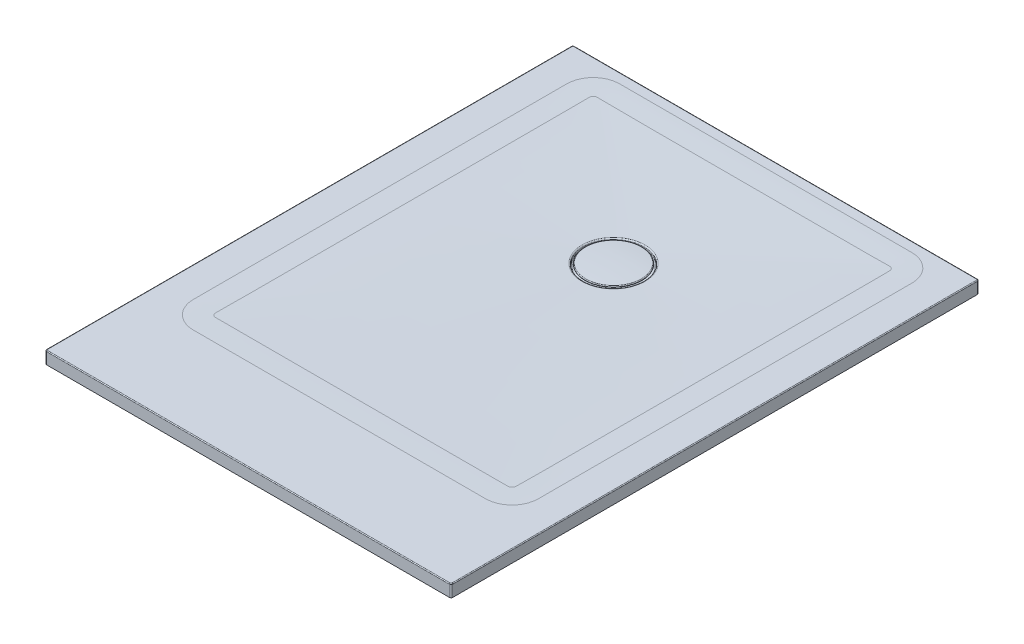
SolidWorks part; units mm, degrees
ref_plane "Płaszczyzna przednia" through (0, 0, 0) normal (0, 0, 1) x (1, 0, 0)
ref_plane "Płaszczyzna górna" through (0, 0, 0) normal (0, 1, 0) x (1, 0, 0)
ref_plane "Płaszczyzna prawa" through (0, 0, 0) normal (1, 0, 0) x (0, 0, -1)
sketch "Szkic2" plane through (0, 0, 0) normal (0, 1, 0) x (1, 0, 0)
  line L0 (0, 650) -> (0, 250) construction
  line L1 (-500, -650) -> (500, -650)
  line L2 (-500, -650) -> (-500, 650)
  line L3 (-500, 650) -> (500, 650)
  line L4 (500, -650) -> (500, 650)
  line L5 (-500, -650) -> (500, 650) construction
  line L6 (-500, 650) -> (500, -650) construction
  line L7 (-410, 610) -> (410, 610)
  line L8 (-410, 610) -> (-410, -410)
  line L9 (-410, -410) -> (410, -410)
  line L10 (410, 610) -> (410, -410)
  line L11 (-450, 650) -> (-450, -450) construction
  line L12 (-450, -450) -> (450, -450) construction
  line L13 (450, -450) -> (450, 650) construction
  circle A0 centre (0, 250) radius 75
  point P0 (0, 0)
  point P11 (0, 610)
  point P16 (0, -450)
  dimension "D9" = 150
  dimension "D1" = 1000
  dimension "D2" = 1300
  dimension "D3" = 40
  dimension "D4" = 90
  dimension "D5" = 40
  dimension "D6" = 50
  dimension "D7" = 1100
  dimension "D8" = 400
  dimension "D10" = 900
sketch "Szkic3" plane through (0, 0, 0) normal (0, 1, 0) x (1, 0, 0)
  line L0 (-500, -650) -> (-500, 650) construction
  line L1 (-500, -650) -> (500, -650) construction
  line L2 (500, -650) -> (500, 650) construction
  line L3 (-500, 650) -> (500, 650) construction
  line L4 (-410, 610) -> (-410, -410) construction
  line L5 (-410, 610) -> (410, 610) construction
  line L6 (410, 610) -> (410, -410) construction
  line L7 (-410, -410) -> (410, -410) construction
  line L8 (-500, -650) -> (-500, 650)
  line L9 (-500, -650) -> (500, -650)
  line L10 (500, -650) -> (500, 650)
  line L11 (-500, 650) -> (500, 650)
  line L12 (-410, 560) -> (-410, -360)
  line L13 (-360, 610) -> (360, 610)
  line L14 (410, 560) -> (410, -360)
  line L15 (-360, -410) -> (360, -410)
  arc A0 (410, 560) -> (360, 610) centre (360, 560) ccw
  arc A1 (-360, 610) -> (-410, 560) centre (-360, 560) ccw
  arc A2 (360, -410) -> (410, -360) centre (360, -360) ccw
  arc A3 (-360, -410) -> (-410, -360) centre (-360, -360) cw
  dimension "D1" = 50
surface "Powierzchnia-Płaszczyzna1" sketch "Szkic3"
sketch "Szkic4" plane through (0, 0, 0) normal (0, 1, 0) x (1, 0, 0)
  line L0 (-410, 610) -> (-410, -410) construction
  line L1 (-410, -410) -> (410, -410) construction
  line L2 (410, 610) -> (410, -410) construction
  line L3 (-410, 610) -> (410, 610) construction
  line L4 (-410, 610) -> (-410, -410)
  line L5 (-410, -410) -> (410, -410)
  line L6 (410, 610) -> (410, -410)
  line L7 (-410, 610) -> (410, 610)
ref_plane "korek" through (0, -15, 0) normal (0, 1, 0) x (-1, 0, 0)
sketch "Szkic5" plane through (0, -15, 0) normal (0, 1, 0) x (-1, 0, 0)
  circle A0 centre (0, -250) radius 75 construction
  circle A1 centre (0, -250) radius 75
surface "Powierzchnia-Wyciągnięcie po profilach2"
surface "Powierzchnia-Połącz1"
sketch "Szkic7" plane through (0, 0, 0) normal (0, 1, 0) x (1, 0, 0)
  line L27 (360, 570) -> (-360, 570)
  line L28 (-370, 560) -> (-370, -360)
  line L29 (-360, -370) -> (360, -370)
  line L30 (370, -360) -> (370, 560)
  line L31 (360, 570) -> (-360, 570)
  line L32 (-370, 560) -> (-370, -360)
  line L33 (-360, -370) -> (360, -370)
  line L34 (370, -360) -> (370, 560)
  line L35 (360, 625) -> (-360, 625)
  line L36 (-425, 560) -> (-425, -360)
  line L37 (-360, -425) -> (360, -425)
  line L38 (425, -360) -> (425, 560)
  line L39 (360, 625) -> (-360, 625)
  line L40 (-425, 560) -> (-425, -360)
  line L41 (-360, -425) -> (360, -425)
  line L42 (425, -360) -> (425, 560)
  arc A0 (370, -360) -> (360, -370) centre (360, -360) cw
  arc A1 (-370, -360) -> (-360, -370) centre (-360, -360) ccw
  arc A2 (370, 560) -> (360, 570) centre (360, 560) ccw
  arc A3 (-370, 560) -> (-360, 570) centre (-360, 560) cw
  spline S23 degree 3 poles (-591.6118, 285.5954) (182.5036, 455.0072) (377.0274, 525.6648) (369.7448, 562.2676) (369.6661, 562.5843) (369.4757, 563.2121) (369.3642, 563.5243) (368.988, 564.4321) (368.6812, 565.0063) (368.1376, 565.8212) (367.9416, 566.0859) (367.5238, 566.5956) (367.3039, 566.838) (366.6126, 567.5299) (366.1097, 567.9438) (365.2907, 568.4922) (365.0068, 568.6625) (364.43, 568.9712) (364.1354, 569.1107) (363.5343, 569.3603) (363.2277, 569.4705) (362.6024, 569.6612) (362.282, 569.7413) (361.6362, 569.8713) (361.3114, 569.9186) (360.8216, 569.967) (360.658, 569.9803) (347.6095, 570.6434) (331.0947, 538.6328) (432.467, 1567.3466) knots -6.976657 -6.976657 -6.976657 -6.976657 0.125 0.125 0.1875 0.1875 0.25 0.25 0.375 0.375 0.4375 0.4375 0.5 0.5 0.625 0.625 0.6875 0.6875 0.75 0.75 0.8125 0.8125 0.875 0.875 0.9375 0.9375 0.96875 0.96875 3.42199 3.42199 3.42199 3.42199 only from (370, 560) to (360, 570)
  spline S24 degree 3 poles (-490.2746, 1561.4753) (-329.0821, 538.5443) (-347.5771, 570.6441) (-360.657, 569.9803) (-360.8198, 569.9671) (-361.3069, 569.9191) (-361.629, 569.8724) (-362.2676, 569.7446) (-362.5844, 569.666) (-363.2123, 569.4758) (-363.5244, 569.3641) (-364.4323, 568.9881) (-365.0064, 568.6812) (-365.8214, 568.1375) (-366.0862, 567.9415) (-366.5957, 567.5237) (-366.8382, 567.3038) (-367.5299, 566.6125) (-367.9439, 566.1095) (-368.4922, 565.2905) (-368.6624, 565.0067) (-368.9713, 564.4299) (-369.1107, 564.1354) (-369.3603, 563.5342) (-369.4704, 563.2276) (-369.6613, 562.6023) (-369.7416, 562.282) (-379.3458, 514.2897) (-36.4064, 427.4202) (597.7666, 308.1619) knots -2.434984 -2.434984 -2.434984 -2.434984 0.03125 0.03125 0.0625 0.0625 0.125 0.125 0.1875 0.1875 0.25 0.25 0.375 0.375 0.4375 0.4375 0.5 0.5 0.625 0.625 0.6875 0.6875 0.75 0.75 0.8125 0.8125 0.875 0.875 10.101399 10.101399 10.101399 10.101399 only from (-360, 570) to (-370, 560)
  spline S25 degree 3 poles (591.6121, -85.5953) (-182.5036, -255.0072) (-377.0274, -325.6648) (-369.7448, -362.2676) (-369.6661, -362.5843) (-369.4757, -363.2121) (-369.3642, -363.5243) (-368.988, -364.4321) (-368.6812, -365.0063) (-368.1376, -365.8212) (-367.9416, -366.0859) (-367.5238, -366.5956) (-367.3039, -366.838) (-366.6126, -367.5299) (-366.1097, -367.9438) (-365.2907, -368.4922) (-365.0068, -368.6625) (-364.43, -368.9712) (-364.1354, -369.1107) (-363.5343, -369.3603) (-363.2277, -369.4705) (-362.6024, -369.6612) (-362.282, -369.7413) (-361.6362, -369.8713) (-361.3114, -369.9186) (-360.8216, -369.967) (-360.658, -369.9803) (-347.6095, -370.6434) (-331.0947, -338.6328) (-432.467, -1367.3466) knots -6.976657 -6.976657 -6.976657 -6.976657 0.125 0.125 0.1875 0.1875 0.25 0.25 0.375 0.375 0.4375 0.4375 0.5 0.5 0.625 0.625 0.6875 0.6875 0.75 0.75 0.8125 0.8125 0.875 0.875 0.9375 0.9375 0.96875 0.96875 3.42199 3.42199 3.42199 3.42199 only from (-370, -360) to (-360, -370)
  spline S26 degree 3 poles (490.2746, -1361.4751) (329.0821, -338.5443) (347.5771, -370.6441) (360.657, -369.9803) (360.8198, -369.9671) (361.3069, -369.9191) (361.629, -369.8724) (362.2676, -369.7446) (362.5844, -369.666) (363.2123, -369.4758) (363.5244, -369.3641) (364.4323, -368.9881) (365.0064, -368.6812) (365.8214, -368.1375) (366.0862, -367.9415) (366.5957, -367.5237) (366.8382, -367.3038) (367.5299, -366.6125) (367.9439, -366.1095) (368.4922, -365.2905) (368.6624, -365.0067) (368.9713, -364.4299) (369.1107, -364.1354) (369.3603, -363.5342) (369.4704, -363.2276) (369.6613, -362.6023) (369.7416, -362.282) (379.3458, -314.2897) (36.4064, -227.4202) (-597.7666, -108.1619) knots -2.434984 -2.434984 -2.434984 -2.434984 0.03125 0.03125 0.0625 0.0625 0.125 0.125 0.1875 0.1875 0.25 0.25 0.375 0.375 0.4375 0.4375 0.5 0.5 0.625 0.625 0.6875 0.6875 0.75 0.75 0.8125 0.8125 0.875 0.875 10.101399 10.101399 10.101399 10.101399 only from (360, -370) to (370, -360)
  spline S31 degree 3 poles (-2396.7641, -416.5637) (-141.6727, 137.224) (456.3366, 408.6659) (423.3422, 574.7388) (422.8286, 576.7972) (421.9015, 579.8581) (421.5658, 580.8756) (420.844, 582.8942) (420.4597, 583.8906) (418.4227, 588.8082) (416.4284, 592.5401) (413.4836, 596.9544) (412.8719, 597.8247) (411.602, 599.5395) (410.9422, 600.3861) (408.9052, 602.8704) (407.4762, 604.4466) (402.9826, 608.9435) (399.7135, 611.6341) (395.2773, 614.6045) (394.3699, 615.1802) (392.5353, 616.2814) (391.6079, 616.8073) (388.7957, 618.3124) (386.8812, 619.2189) (382.9738, 620.8415) (380.9809, 621.5575) (377.9322, 622.4867) (376.9059, 622.7721) (374.8332, 623.2937) (373.7848, 623.5304) (370.636, 624.1602) (368.5249, 624.4734) (365.3411, 624.7884) (364.2771, 624.8686) (221.1012, 631.9728) (25.0091, 152.9101) (265.0303, 3601.0082) knots -4.813168 -4.813168 -4.813168 -4.813168 0.125 0.125 0.1875 0.1875 0.21875 0.21875 0.25 0.25 0.375 0.375 0.40625 0.40625 0.4375 0.4375 0.5 0.5 0.625 0.625 0.65625 0.65625 0.6875 0.6875 0.75 0.75 0.8125 0.8125 0.84375 0.84375 0.875 0.875 0.9375 0.9375 0.96875 0.96875 5.130618 5.130618 5.130618 5.130618 only from (425, 560) to (360, 625)
  spline S32 degree 3 poles (-415.8595, 3598.7851) (29.0708, 99.1406) (-213.1262, 632.3577) (-364.2695, 624.869) (-365.3289, 624.7893) (-368.4945, 624.477) (-370.5877, 624.1674) (-374.7388, 623.3419) (-376.7973, 622.8285) (-379.8582, 621.9015) (-380.8757, 621.5657) (-382.8943, 620.844) (-383.8907, 620.4597) (-388.8083, 618.4228) (-392.5402, 616.4283) (-396.9546, 613.4835) (-397.8248, 612.8718) (-399.5396, 611.6019) (-400.3863, 610.9421) (-402.8705, 608.9051) (-404.4468, 607.4761) (-408.9435, 602.9825) (-411.6342, 599.7134) (-414.6045, 595.2773) (-415.1803, 594.3698) (-416.2814, 592.5352) (-416.8073, 591.6078) (-418.3124, 588.7957) (-419.2189, 586.8811) (-420.8415, 582.9737) (-421.5574, 580.9808) (-422.4867, 577.9321) (-422.7721, 576.9059) (-423.2937, 574.8332) (-423.5304, 573.7848) (-462.8094, 377.2436) (405.121, 81.0334) (2419.4038, -342.4744) knots -4.376745 -4.376745 -4.376745 -4.376745 0.03125 0.03125 0.0625 0.0625 0.125 0.125 0.1875 0.1875 0.21875 0.21875 0.25 0.25 0.375 0.375 0.40625 0.40625 0.4375 0.4375 0.5 0.5 0.625 0.625 0.65625 0.65625 0.6875 0.6875 0.75 0.75 0.8125 0.8125 0.84375 0.84375 0.875 0.875 6.695249 6.695249 6.695249 6.695249 only from (-360, 625) to (-425, 560)
  spline S33 degree 3 poles (2396.7641, 616.5637) (141.6727, 62.776) (-456.3366, -208.6659) (-423.3422, -374.7388) (-422.8286, -376.7972) (-421.9015, -379.8581) (-421.5658, -380.8756) (-420.844, -382.8942) (-420.4597, -383.8906) (-418.4227, -388.8082) (-416.4284, -392.5401) (-413.4836, -396.9544) (-412.8719, -397.8247) (-411.602, -399.5395) (-410.9422, -400.3861) (-408.9052, -402.8704) (-407.4762, -404.4466) (-402.9826, -408.9435) (-399.7135, -411.6341) (-395.2773, -414.6045) (-394.3699, -415.1802) (-392.5353, -416.2814) (-391.6079, -416.8073) (-388.7957, -418.3124) (-386.8812, -419.2189) (-382.9738, -420.8415) (-380.9809, -421.5575) (-377.9322, -422.4867) (-376.9059, -422.7721) (-374.8332, -423.2937) (-373.7848, -423.5304) (-370.636, -424.1602) (-368.5249, -424.4734) (-365.3411, -424.7884) (-364.2771, -424.8686) (-221.1012, -431.9728) (-25.0091, 47.0899) (-265.0303, -3401.0082) knots -4.813168 -4.813168 -4.813168 -4.813168 0.125 0.125 0.1875 0.1875 0.21875 0.21875 0.25 0.25 0.375 0.375 0.40625 0.40625 0.4375 0.4375 0.5 0.5 0.625 0.625 0.65625 0.65625 0.6875 0.6875 0.75 0.75 0.8125 0.8125 0.84375 0.84375 0.875 0.875 0.9375 0.9375 0.96875 0.96875 5.130618 5.130618 5.130618 5.130618 only from (-425, -360) to (-360, -425)
  spline S34 degree 3 poles (415.8595, -3398.7854) (-29.0708, 100.8594) (213.1262, -432.3577) (364.2695, -424.869) (365.3289, -424.7893) (368.4945, -424.477) (370.5877, -424.1674) (374.7388, -423.3419) (376.7973, -422.8285) (379.8582, -421.9015) (380.8757, -421.5657) (382.8943, -420.844) (383.8907, -420.4597) (388.8083, -418.4228) (392.5402, -416.4283) (396.9546, -413.4835) (397.8248, -412.8718) (399.5396, -411.6019) (400.3863, -410.9421) (402.8705, -408.9051) (404.4468, -407.4761) (408.9435, -402.9825) (411.6342, -399.7134) (414.6045, -395.2773) (415.1803, -394.3698) (416.2814, -392.5352) (416.8073, -391.6078) (418.3124, -388.7957) (419.2189, -386.8811) (420.8415, -382.9737) (421.5574, -380.9808) (422.4867, -377.9321) (422.7721, -376.9059) (423.2937, -374.8332) (423.5304, -373.7848) (462.8094, -177.2436) (-405.121, 118.9666) (-2419.4038, 542.4744) knots -4.376745 -4.376745 -4.376745 -4.376745 0.03125 0.03125 0.0625 0.0625 0.125 0.125 0.1875 0.1875 0.21875 0.21875 0.25 0.25 0.375 0.375 0.40625 0.40625 0.4375 0.4375 0.5 0.5 0.625 0.625 0.65625 0.65625 0.6875 0.6875 0.75 0.75 0.8125 0.8125 0.84375 0.84375 0.875 0.875 6.695249 6.695249 6.695249 6.695249 only from (360, -425) to (425, -360)
  spline S35 degree 3 poles (425, 560) (425, 564.2918) (424.5793, 568.5119) (423.3422, 574.7388) (422.8286, 576.7972) (421.9015, 579.8581) (421.5658, 580.8756) (420.844, 582.8942) (420.4597, 583.8906) (418.4227, 588.8082) (416.4284, 592.5401) (413.4836, 596.9544) (412.8719, 597.8247) (411.602, 599.5395) (410.9422, 600.3861) (408.9052, 602.8704) (407.4762, 604.4466) (402.9826, 608.9435) (399.7135, 611.6341) (395.2773, 614.6045) (394.3699, 615.1802) (392.5353, 616.2814) (391.6079, 616.8073) (388.7957, 618.3124) (386.8812, 619.2189) (382.9738, 620.8415) (380.9809, 621.5575) (377.9322, 622.4867) (376.9059, 622.7721) (374.8332, 623.2937) (373.7848, 623.5304) (370.636, 624.1602) (368.5249, 624.4734) (365.3411, 624.7884) (364.2771, 624.8686) (362.143, 624.9745) (361.0729, 625) (360, 625) knots 0 0 0 0 0.125 0.125 0.1875 0.1875 0.21875 0.21875 0.25 0.25 0.375 0.375 0.40625 0.40625 0.4375 0.4375 0.5 0.5 0.625 0.625 0.65625 0.65625 0.6875 0.6875 0.75 0.75 0.8125 0.8125 0.84375 0.84375 0.875 0.875 0.9375 0.9375 0.96875 0.96875 1 1 1 1
  spline S36 degree 3 poles (-360, 625) (-361.073, 625) (-362.1416, 624.9745) (-364.2695, 624.869) (-365.3289, 624.7893) (-368.4945, 624.477) (-370.5877, 624.1674) (-374.7388, 623.3419) (-376.7973, 622.8285) (-379.8582, 621.9015) (-380.8757, 621.5657) (-382.8943, 620.844) (-383.8907, 620.4597) (-388.8083, 618.4228) (-392.5402, 616.4283) (-396.9546, 613.4835) (-397.8248, 612.8718) (-399.5396, 611.6019) (-400.3863, 610.9421) (-402.8705, 608.9051) (-404.4468, 607.4761) (-408.9435, 602.9825) (-411.6342, 599.7134) (-414.6045, 595.2773) (-415.1803, 594.3698) (-416.2814, 592.5352) (-416.8073, 591.6078) (-418.3124, 588.7957) (-419.2189, 586.8811) (-420.8415, 582.9737) (-421.5574, 580.9808) (-422.4867, 577.9321) (-422.7721, 576.9059) (-423.2937, 574.8332) (-423.5304, 573.7848) (-424.5793, 568.5367) (-425, 564.2917) (-425, 560) knots 0 0 0 0 0.03125 0.03125 0.0625 0.0625 0.125 0.125 0.1875 0.1875 0.21875 0.21875 0.25 0.25 0.375 0.375 0.40625 0.40625 0.4375 0.4375 0.5 0.5 0.625 0.625 0.65625 0.65625 0.6875 0.6875 0.75 0.75 0.8125 0.8125 0.84375 0.84375 0.875 0.875 1 1 1 1
  spline S37 degree 3 poles (-425, -360) (-425, -364.2918) (-424.5793, -368.5119) (-423.3422, -374.7388) (-422.8286, -376.7972) (-421.9015, -379.8581) (-421.5658, -380.8756) (-420.844, -382.8942) (-420.4597, -383.8906) (-418.4227, -388.8082) (-416.4284, -392.5401) (-413.4836, -396.9544) (-412.8719, -397.8247) (-411.602, -399.5395) (-410.9422, -400.3861) (-408.9052, -402.8704) (-407.4762, -404.4466) (-402.9826, -408.9435) (-399.7135, -411.6341) (-395.2773, -414.6045) (-394.3699, -415.1802) (-392.5353, -416.2814) (-391.6079, -416.8073) (-388.7957, -418.3124) (-386.8812, -419.2189) (-382.9738, -420.8415) (-380.9809, -421.5575) (-377.9322, -422.4867) (-376.9059, -422.7721) (-374.8332, -423.2937) (-373.7848, -423.5304) (-370.636, -424.1602) (-368.5249, -424.4734) (-365.3411, -424.7884) (-364.2771, -424.8686) (-362.143, -424.9745) (-361.0729, -425) (-360, -425) knots 0 0 0 0 0.125 0.125 0.1875 0.1875 0.21875 0.21875 0.25 0.25 0.375 0.375 0.40625 0.40625 0.4375 0.4375 0.5 0.5 0.625 0.625 0.65625 0.65625 0.6875 0.6875 0.75 0.75 0.8125 0.8125 0.84375 0.84375 0.875 0.875 0.9375 0.9375 0.96875 0.96875 1 1 1 1
  spline S38 degree 3 poles (360, -425) (361.073, -425) (362.1416, -424.9745) (364.2695, -424.869) (365.3289, -424.7893) (368.4945, -424.477) (370.5877, -424.1674) (374.7388, -423.3419) (376.7973, -422.8285) (379.8582, -421.9015) (380.8757, -421.5657) (382.8943, -420.844) (383.8907, -420.4597) (388.8083, -418.4228) (392.5402, -416.4283) (396.9546, -413.4835) (397.8248, -412.8718) (399.5396, -411.6019) (400.3863, -410.9421) (402.8705, -408.9051) (404.4468, -407.4761) (408.9435, -402.9825) (411.6342, -399.7134) (414.6045, -395.2773) (415.1803, -394.3698) (416.2814, -392.5352) (416.8073, -391.6078) (418.3124, -388.7957) (419.2189, -386.8811) (420.8415, -382.9737) (421.5574, -380.9808) (422.4867, -377.9321) (422.7721, -376.9059) (423.2937, -374.8332) (423.5304, -373.7848) (424.5793, -368.5367) (425, -364.2917) (425, -360) knots 0 0 0 0 0.03125 0.03125 0.0625 0.0625 0.125 0.125 0.1875 0.1875 0.21875 0.21875 0.25 0.25 0.375 0.375 0.40625 0.40625 0.4375 0.4375 0.5 0.5 0.625 0.625 0.65625 0.65625 0.6875 0.6875 0.75 0.75 0.8125 0.8125 0.84375 0.84375 0.875 0.875 1 1 1 1
  dimension "D3" = 10
  dimension "D1" = 40
  dimension "D2" = 15
other "Usuń ścianę1"
other "Granica-Powierzchnia1"
surface "Powierzchnia-Połącz2"
sketch "Szkic9" plane through (0, 0, 0) normal (0, 1, 0) x (1, 0, 0)
  line L0 (-500, -650) -> (500, -650) construction
  line L1 (-500, -650) -> (-500, 650) construction
  line L2 (500, -650) -> (500, 650) construction
  line L3 (-500, 650) -> (500, 650) construction
  line L4 (-500, -650) -> (500, -650)
  line L5 (-500, -650) -> (-500, 650)
  line L6 (500, -650) -> (500, 650)
  line L7 (-500, 650) -> (500, 650)
surface "Powierzchnia-Wyciągnięcie1" sketch "Szkic9" parameters "D1"=30
sketch "Szkic8" plane through (0, 0, 0) normal (1, 0, 0) x (0, 0, -1)
  line L0 (250, 0) -> (250, -30) construction
  line L1 (174.9999, -15) -> (175.2968, -23.5)
  line L4 (175.2968, -23.5) -> (198, -24.0945)
  line L5 (175.2968, -23.5) -> (250, -23.5) construction
  line L6 (198, -24.0945) -> (198, -30) construction
  line L7 (250, -30) -> (175.2968, -30) construction
  line L8 (175.2968, -30) -> (175.2968, -23.5) construction
  line L9 (205, -28) -> (205, -30)
  line L10 (198, -24.0945) -> (205, -28)
  dimension "D1" = 30
  dimension "D2" = 8.5
  dimension "D3" = 2
  dimension "D4" = 1.5
  dimension "D5" = 52
  dimension "D6" = 45
  dimension "D7" = 2
surface "Powierzchnia-Obrót1" sketch "Szkic8" parameters "D1"=360
surface "Powierzchnia-Płaszczyzna2"
surface "Powierzchnia-Połącz3"
fillet "Zaokrąglenie4" radius 4 4 edges at (-500, -15, -650) (500, -15, -650) (-500, -15, 650) (500, -15, 650)
fillet "Zaokrąglenie5" radius 3 3 edges at (0, -24.0945, -302) (0, -23.5, -324.7032)
fillet "Zaokrąglenie6" radius 2 9 edges at (498.8284, 0, 648.8284) (0, 0, 650) (-498.8284, 0, 648.8284) (-500, 0, 0) (-498.8284, 0, -648.8284) (0, 0, -650) (498.8284, 0, -648.8284) (500, 0, 0) (0, -28, -295)
sketch "Szkic11" plane through (0, 0, 0) normal (1, 0, 0) x (0, 0, -1)
  line L0 (250, 0) -> (250, -30) construction
  line L1 (-646, -30) -> (646, -30) construction
  line L2 (250, -17) -> (250, -11.5)
  line L14 (320, -11.5) -> (320, -14.5) construction
  line L16 (320, -17) -> (250, -17)
  line L18 (320, -17) -> (320, -16.3377)
  line L19 (250, -11.5) -> (320, -11.5) construction
  arc A0 (320, -16.3377) -> (318.1666, -14.3446) centre (318, -16.3377) ccw
  arc A6 (318.1666, -14.3446) -> (250, -11.5) centre (250, -829.6667) ccw
  dimension "D2" = 2
  dimension "D8" = 2.5
  dimension "D9" = 17
  dimension "D10" = 5.5
  dimension "D11" = 70
revolve "Obrót1" add sketch "Szkic11" angle 360 about L0
